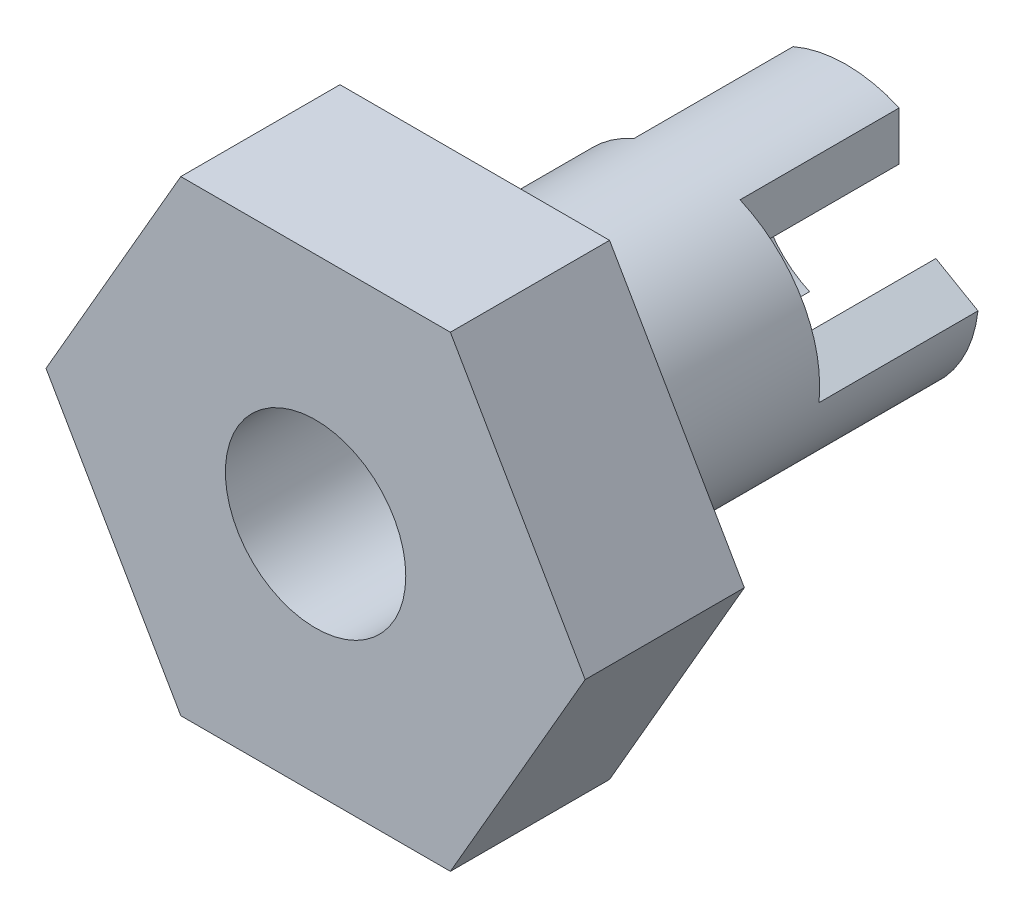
SolidWorks part; units mm, degrees
ref_plane "Front Plane" through (0, 0, 0) normal (0, 0, 1) x (1, 0, 0)
ref_plane "Top Plane" through (0, 0, 0) normal (0, 1, 0) x (1, 0, 0)
ref_plane "Right Plane" through (0, 0, 0) normal (1, 0, 0) x (0, 0, -1)
sketch "Sketch1" plane through (0, 0, 0) normal (0, 0, 1) x (1, 0, 0)
  line L1 (6.4525, 0) -> (3.2262, 5.588)
  line L2 (3.2262, 5.588) -> (-3.2262, 5.588)
  line L3 (-3.2262, 5.588) -> (-6.4525, 0)
  line L4 (-6.4525, 0) -> (-3.2262, -5.588)
  line L5 (-3.2262, -5.588) -> (3.2262, -5.588)
  line L6 (3.2262, -5.588) -> (6.4525, 0)
  circle A0 centre (0, 0) radius 5.588 construction
  dimension "D1" = 11.176
extrude "Boss-Extrude1" add sketch "Sketch1" along normal blind 3.81
sketch "Sketch3" plane through (0, 0, 3.81) normal (0, 0, 1) x (1, 0, 0)
  circle A0 centre (0, 0) radius 2.159
  dimension "D1" = 4.318
extrude "Cut-Extrude1" cut sketch "Sketch3" against normal through all
sketch "Sketch5" plane through (0, 0, 0) normal (0, 0, -1) x (-1, 0, 0)
  circle A0 centre (0, 0) radius 3.175
  circle A1 centre (0, 0) radius 2.159
  dimension "D1" = 6.35
  dimension "D2" = 4.318
extrude "Boss-Extrude2" add sketch "Sketch5" along normal blind 5.08
sketch "Sketch6" plane through (0, 0, -5.08) normal (0, 0, -1) x (-1, 0, 0)
  line L0 (1.27, 2.9099) -> (1.27, 1.746)
  line L1 (-1.27, 2.9099) -> (-1.27, 1.746)
  line L2 (0, 0) -> (0, 4.4171) construction
  line L3 (3.1551, -0.3551) -> (2.147, 0.2269)
  line L4 (1.8851, -2.5548) -> (0.877, -1.9728)
  line L5 (-1.8851, -2.5548) -> (-0.877, -1.9728)
  line L6 (-3.1551, -0.3551) -> (-2.147, 0.2269)
  arc A0 (1.27, 2.9099) -> (-1.27, 2.9099) centre (0, 0) ccw
  arc A1 (1.27, 1.746) -> (-1.27, 1.746) centre (0, 0) ccw
  arc A2 (0.877, -1.9728) -> (2.147, 0.2269) centre (0, 0) ccw
  arc A3 (1.8851, -2.5548) -> (3.1551, -0.3551) centre (0, 0) ccw
  arc A4 (-2.147, 0.2269) -> (-0.877, -1.9728) centre (0, 0) ccw
  arc A5 (-3.1551, -0.3551) -> (-1.8851, -2.5548) centre (0, 0) ccw
  point P17 (0, 0)
  dimension "D4" = 2.159
  dimension "D1" = 1.27
  dimension "D2" = 2.54
  dimension "D3" = 3
extrude "Boss-Extrude3" add sketch "Sketch6" along normal blind 3.81
